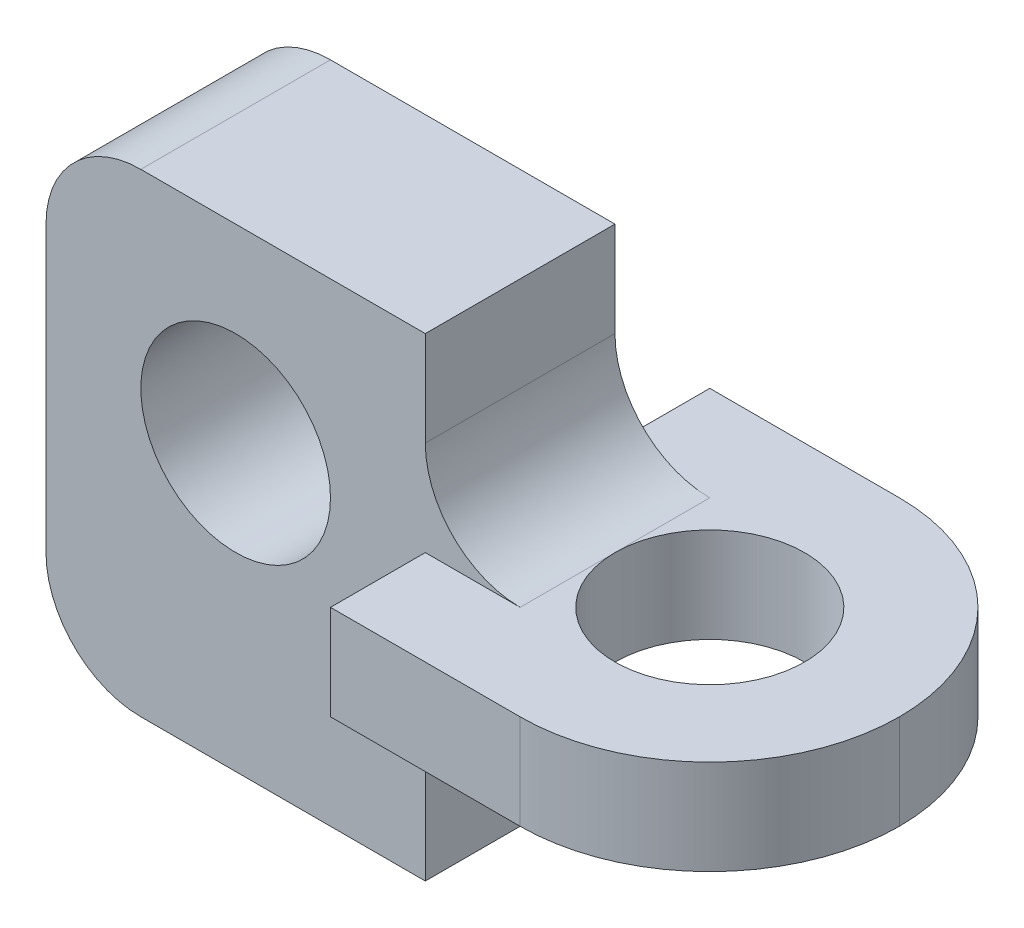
SolidWorks part; units mm, degrees
ref_plane "Front Plane" through (0, 0, 0) normal (0, 0, 1) x (1, 0, 0)
ref_plane "Top Plane" through (0, 0, 0) normal (0, 1, 0) x (1, 0, 0)
ref_plane "Right Plane" through (0, 0, 0) normal (1, 0, 0) x (0, 0, -1)
sketch "Sketch1" plane through (0, 0, 0) normal (0, 0, 1) x (1, 0, 0)
  line L1 (-20, 20) -> (20, 20)
  line L2 (-20, 20) -> (-20, -30)
  line L3 (-20, -30) -> (20, -30)
  line L4 (20, 20) -> (20, -30)
  circle A0 centre (0, 0) radius 10
  dimension "D1" = 20
  dimension "D2" = 20
  dimension "D3" = 50
  dimension "D4" = 20
  dimension "D5" = 40
extrude "Extrude1" add sketch "Sketch1" along normal mid plane 20
sketch "Sketch2" plane through (0, 0, 0) normal (0, 1, 0) x (1, 0, 0)
  line L0 (0, 0) -> (68.4601, 0) construction
  line L1 (20, 20) -> (60, 20)
  line L2 (20, 20) -> (20, -20)
  line L3 (20, -20) -> (60, -20)
  line L4 (60, 20) -> (60, -20)
  line L5 (20, -10) -> (20, 10) construction
  dimension "D1" = 40
  dimension "D2" = 40
extrude "Extrude2" add sketch "Sketch2" against normal blind 10
fillet "Fillet1" radius 20 2 edges at (60, -5, -20) (60, -5, 20)
sketch "Sketch3" plane through (0, 0, 0) normal (0, 1, 0) x (1, 0, 0)
  circle A0 centre (40, 0) radius 10
  dimension "D1" = 20
extrude "Extrude3" cut sketch "Sketch3" against normal through all
fillet "Fillet2" radius 10 4 edges at (20, -10, 0) (20, 0, 0) (-20, -30, 0) (-20, 20, 0)
